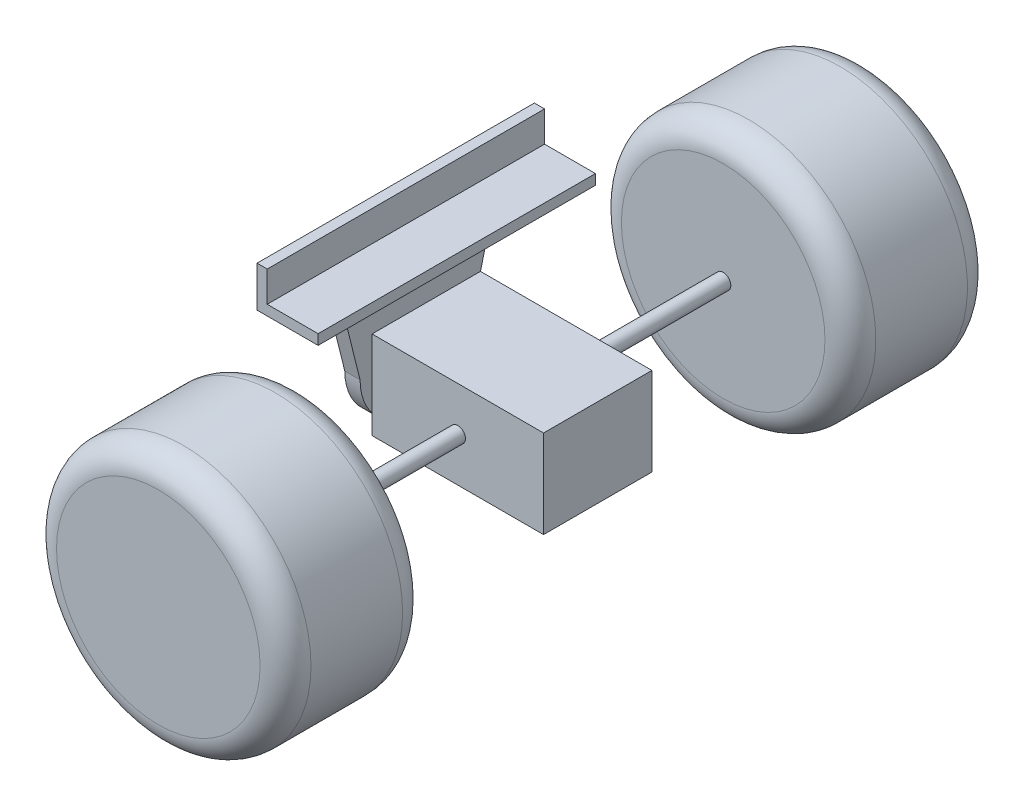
SolidWorks part; units mm, degrees
ref_plane "Front Plane" through (0, 0, 0) normal (0, 0, 1) x (1, 0, 0)
ref_plane "Top Plane" through (0, 0, 0) normal (0, 1, 0) x (1, 0, 0)
ref_plane "Right Plane" through (0, 0, 0) normal (1, 0, 0) x (0, 0, -1)
sketch "Sketch1" plane through (0, 0, 0) normal (0, 0, 1) x (1, 0, 0)
  circle A0 centre (0, 0) radius 1.5
  dimension "D1" = 3
extrude "Boss-Extrude1" add sketch "Sketch1" along normal mid plane 83
sketch "Sketch2" plane through (0, 0, 41.5) normal (0, 0, 1) x (1, 0, 0)
  circle A0 centre (0, 0) radius 25
  dimension "D1" = 50
extrude "Boss-Extrude2" add sketch "Sketch2" along normal blind 28
fillet "Fillet1" radius 5 2 edges at (25, 0, 41.5) (25, 0, 69.5)
mirror "Mirror2" about plane through (0, 0, 0) normal (0, 0, 1) of "Boss-Extrude2", "Fillet1"
sketch "Sketch3" plane through (0, 0, 0) normal (0, 0, 1) x (1, 0, 0)
  line L1 (-16.85, -8.65) -> (16.85, -8.65)
  line L2 (-16.85, -8.65) -> (-16.85, 8.65)
  line L3 (-16.85, 8.65) -> (16.85, 8.65)
  line L4 (16.85, -8.65) -> (16.85, 8.65)
  line L5 (-16.85, -8.65) -> (16.85, 8.65) construction
  line L6 (-16.85, 8.65) -> (16.85, -8.65) construction
  point P0 (0, 0)
  dimension "D1" = 33.7
  dimension "D2" = 17.3
extrude "Boss-Extrude3" add sketch "Sketch3" along normal mid plane 21.3
sketch "Sketch4" plane through (-16.85, 0, 0) normal (-1, 0, 0) x (0, 0, 1)
  circle A0 centre (0, 0) radius 5
extrude "Boss-Extrude4" add sketch "Sketch4" along normal blind 2
sketch "Sketch5" plane through (-18.85, 0, 0) normal (-1, 0, 0) x (0, 0, 1)
  line L0 (11, 0) -> (15.5, 18)
  line L1 (15.5, 18) -> (-15.5, 18)
  line L2 (0, 0) -> (0, 51.0283) construction
  line L3 (-15.5, 18) -> (-11, 0)
  circle A0 centre (0, 0) radius 11
  dimension "D1" = 18
  dimension "D3" = 22
  dimension "D2" = 31
  dimension "D4" = 15.5
extrude "Boss-Extrude5" add sketch "Sketch5" along normal blind 3
sketch "Sketch7" plane through (0, 0, 0) normal (0, 0, 1) x (1, 0, 0)
  line L0 (-18.85, 0) -> (-18.85, 18) construction
  line L1 (-20.85, 18) -> (-22.85, 18)
  line L2 (-20.85, 20) -> (-20.85, 26)
  line L3 (-20.85, 26) -> (-22.85, 26)
  line L4 (-22.85, 18) -> (-22.85, 26)
  line L5 (-20.85, 18) -> (-10.85, 18)
  line L7 (-20.85, 20) -> (-10.85, 20)
  line L8 (-10.85, 18) -> (-10.85, 20)
  line L9 (-21.85, 18) -> (-18.85, 18) construction
  point P8 (0, 0)
  dimension "D1" = 2
  dimension "D2" = 12
  dimension "D3" = 2
  dimension "D4" = 2
  dimension "D5" = 8
extrude "Boss-Extrude6" add sketch "Sketch7" along normal mid plane 54.5 contours L4 L1 L2 L3 | L5 L8 L7 L2
